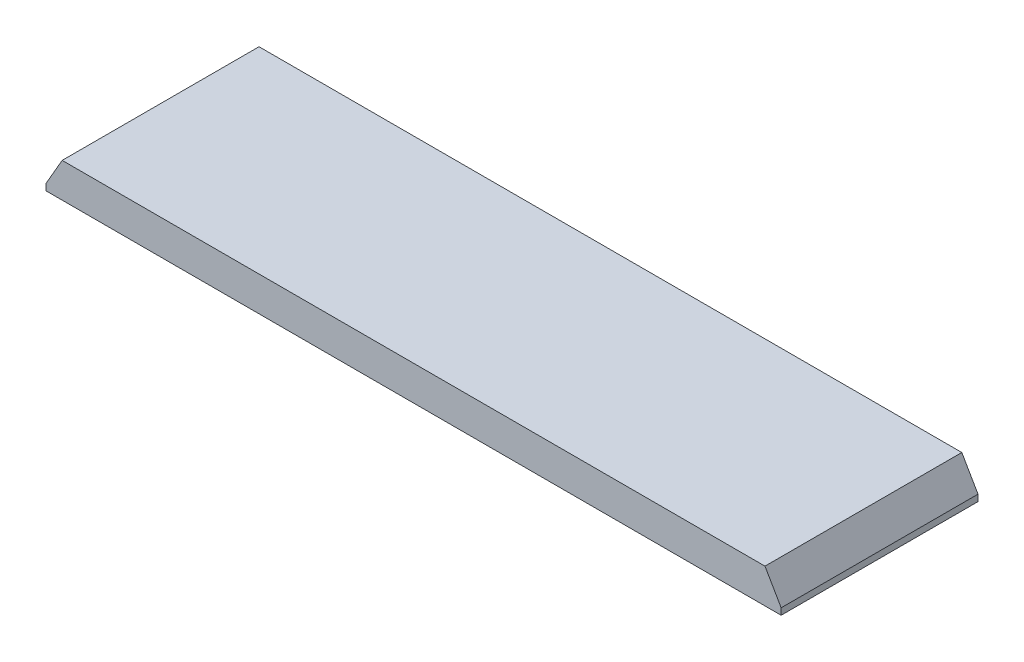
SolidWorks part; units mm, degrees
ref_plane "Front Plane" through (0, 0, 0) normal (1, 0, 0) x (0, 1, 0)
ref_plane "Top Plane" through (0, 0, 0) normal (0, 0, 1) x (0, 1, 0)
ref_plane "Right Plane" through (0, 0, 0) normal (0, 1, 0) x (-1, 0, 0)
sketch "sk w193" plane through (0, 0, 0) normal (0, 0, 1) x (0, 1, 0)
  point P0 (-399.034, -196.596)
  point P3 (-188.214, 0)
  line B0 (-399.034, -196.596) -> (-399.034, -160.02)
  line B1 (-399.034, -160.02) -> (-226.06, -160.02)
  line B2 (-210.82, -144.78) -> (-210.82, 144.78)
  line B3 (-226.06, 160.02) -> (-399.034, 160.02)
  line B4 (-399.034, 160.02) -> (-399.034, 196.596)
  line B5 (-399.034, 196.596) -> (0, 196.596)
  line B6 (0, 196.596) -> (0, 160.02)
  line B7 (0, 160.02) -> (-172.974, 160.02)
  line B8 (-188.214, 144.78) -> (-188.214, -144.78)
  line B9 (-172.974, -160.02) -> (0, -160.02)
  line B10 (0, -160.02) -> (0, -196.596)
  line B11 (0, -196.596) -> (-399.034, -196.596)
  arc B12 (-226.06, -160.02) -> (-210.82, -144.78) centre (-226.06, -144.78) ccw
  arc B13 (-210.82, 144.78) -> (-226.06, 160.02) centre (-226.06, 144.78) ccw
  arc B14 (-172.974, 160.02) -> (-188.214, 144.78) centre (-172.974, 144.78) ccw
  arc B15 (-188.214, -144.78) -> (-172.974, -160.02) centre (-172.974, -144.78) ccw
sketch_block_instance "w14x193-1-1"
sketch_block "w14x193-1" parameters "D4"=15.24, "D1"=399.034, "D2"=393.192, "D3"=22.606, "D5"=36.576
sketch "Sketch2" plane through (0, 0, 0) normal (0, 0, 1) x (0, 1, 0)
  line L0 (320, 501.4782) -> (320, -809.7231)
  line L1 (-188.214, 144.78) -> (-188.214, -144.78)
  line L2 (-188.214, -144.78) -> (-172.974, -160.02)
  line L3 (-172.974, -160.02) -> (5, -160.02)
  line L4 (-188.214, 144.78) -> (-172.974, 160.02)
  line L5 (-172.974, 160.02) -> (5, 160.02)
  line L6 (5, 201.596) -> (5, 160.02)
  line L7 (0, 196.596) -> (0, 160.02) construction
  line L8 (5, -160.02) -> (5, -201.596)
  line L9 (-285.82, 201.596) -> (5, 201.596)
  line L10 (-285.82, -201.596) -> (5, -201.596)
  line L11 (-285.82, 201.596) -> (-285.82, 239.696)
  line L12 (-285.82, 239.696) -> (167.6, 501.4782)
  line L13 (-285.82, -201.596) -> (-285.82, -239.696)
  line L14 (-285.82, -239.696) -> (167.6, -809.7231)
  line L15 (-210.82, -144.78) -> (-210.82, 144.78) construction
  line L16 (-399.034, 196.596) -> (0, 196.596) construction
  line L17 (0, -196.596) -> (-399.034, -196.596) construction
  line L18 (320, 501.4782) -> (167.6, 501.4782)
  line L19 (320, -809.7231) -> (167.6, -809.7231)
  point P30 (320, 501.4782)
  point P31 (320, -809.7231)
  dimension "D1" = 320
  dimension "D2" = 5
  dimension "D3" = 75
  dimension "D4" = 5
  dimension "D5" = 5
  dimension "D6" = 30
  dimension "D7" = 51.5
  dimension "D8" = 38.1
  dimension "D9" = 38.1
  dimension "D10" = 152.4
sketch "Sketch3" plane through (0, 0, 0) normal (0, 1, 0) x (-1, 0, 0)
  line L6 (-541.5415, 145) -> (541.5415, 145)
  line L7 (-541.5415, 145) -> (-541.5415, -145)
  line L8 (-541.5415, -145) -> (541.5415, -145)
  line L9 (541.5415, 145) -> (541.5415, -145)
  point P4 (0, 145)
  point P5 (541.5415, 0)
  dimension "D1" = 290
  dimension "D2" = 1083.083
extrude "Boss-Extrude1" add sketch "Sketch3" along normal blind 50.8
chamfer "Chamfer1" distance 41.275 angle 30 2 edges at (-541.5415, 50.8, 0) (541.5415, 50.8, 0)
